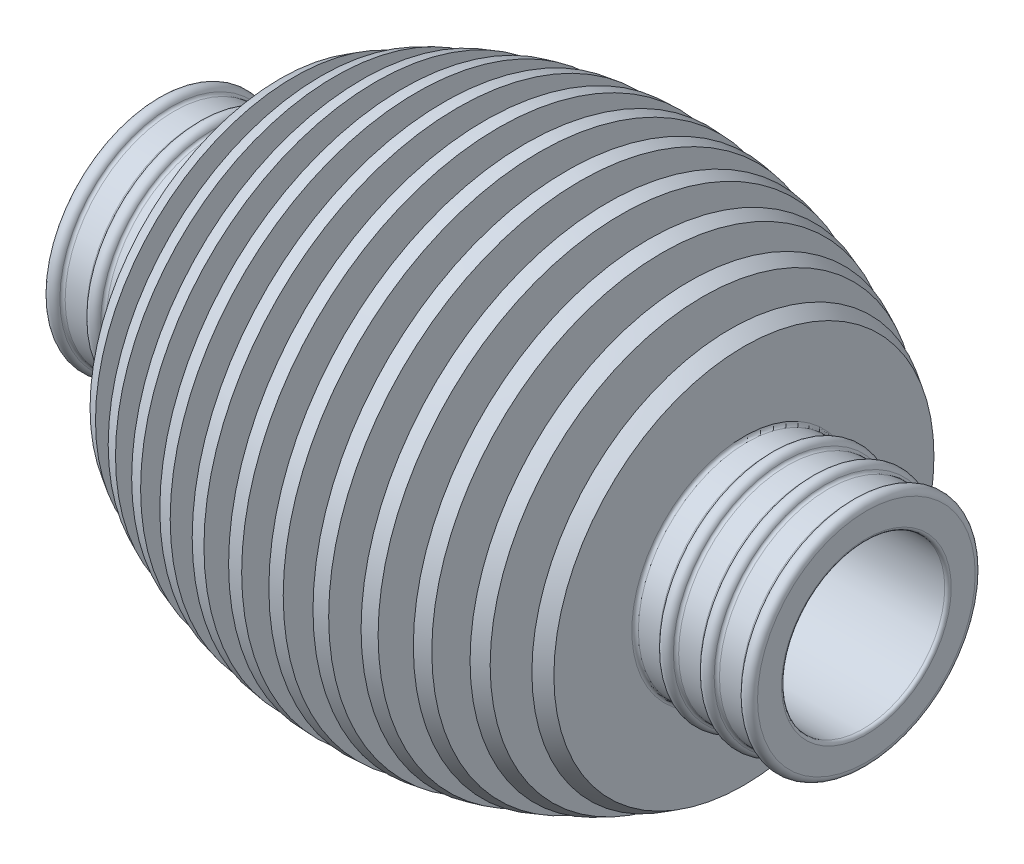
SolidWorks part; units mm, degrees
ref_plane "Front Plane" through (0, 0, 0) normal (0, 0, 1) x (1, 0, 0)
ref_plane "Top Plane" through (0, 0, 0) normal (0, 1, 0) x (1, 0, 0)
ref_plane "Right Plane" through (0, 0, 0) normal (1, 0, 0) x (0, 0, -1)
sketch "Sketch1" plane through (0, 0, 0) normal (0, 0, 1) x (1, 0, 0)
  line L0 (0, 0) -> (-38.2692, 0) construction
  line L1 (0, 9.525) -> (0, 12.7)
  line L2 (1.59, 12.7) -> (4.7625, 12.7)
  line L3 (0, 9.525) -> (82.7075, 9.525)
  line L4 (14.29, 31.75) -> (15.8902, 31.75)
  line L5 (15.8902, 31.75) -> (15.8902, 12.7)
  line L6 (14.29, 12.7) -> (14.29, 31.75)
  line L7 (15.8902, 12.7) -> (19.0652, 12.7)
  line L8 (19.0652, 12.7) -> (19.0652, 31.75)
  line L9 (19.0652, 31.75) -> (20.6654, 31.75)
  line L10 (6.3525, 12.7) -> (9.525, 12.7)
  line L11 (11.115, 12.7) -> (14.29, 12.7)
  line L12 (20.6654, 31.75) -> (20.6654, 12.7)
  line L13 (20.6654, 12.7) -> (23.8404, 12.7)
  line L14 (23.8404, 12.7) -> (23.8404, 31.75)
  line L15 (23.8404, 31.75) -> (25.4406, 31.75)
  line L16 (25.4406, 31.75) -> (25.4406, 12.7)
  line L17 (25.4406, 12.7) -> (28.6156, 12.7)
  line L18 (28.6156, 12.7) -> (28.6156, 31.75)
  line L19 (28.6156, 31.75) -> (30.2158, 31.75)
  line L20 (30.2158, 31.75) -> (30.2158, 12.7)
  line L21 (30.2158, 12.7) -> (33.3908, 12.7)
  line L22 (33.3908, 12.7) -> (33.3908, 31.75)
  line L23 (33.3908, 31.75) -> (34.991, 31.75)
  line L24 (34.991, 31.75) -> (34.991, 12.7)
  line L25 (34.991, 12.7) -> (38.166, 12.7)
  line L26 (38.166, 12.7) -> (38.166, 31.75)
  line L27 (38.166, 31.75) -> (39.7662, 31.75)
  line L28 (39.7662, 31.75) -> (39.7662, 12.7)
  line L29 (39.7662, 12.7) -> (42.9412, 12.7)
  line L30 (42.9412, 12.7) -> (42.9412, 31.75)
  line L31 (42.9412, 31.75) -> (44.5414, 31.75)
  line L32 (44.5414, 31.75) -> (44.5414, 12.7)
  line L33 (44.5414, 12.7) -> (47.7164, 12.7)
  line L34 (47.7164, 12.7) -> (47.7164, 31.75)
  line L35 (47.7164, 31.75) -> (49.3166, 31.75)
  line L36 (49.3166, 31.75) -> (49.3166, 12.7)
  line L37 (49.3166, 12.7) -> (52.4916, 12.7)
  line L38 (52.4916, 12.7) -> (52.4916, 31.75)
  line L39 (52.4916, 31.75) -> (54.0918, 31.75)
  line L40 (54.0918, 31.75) -> (54.0918, 12.7)
  line L41 (54.0918, 12.7) -> (57.2668, 12.7)
  line L42 (57.2668, 12.7) -> (57.2668, 31.75)
  line L43 (57.2668, 31.75) -> (58.867, 31.75)
  line L44 (58.867, 31.75) -> (58.867, 12.7)
  line L45 (58.867, 12.7) -> (62.042, 12.7)
  line L46 (62.042, 12.7) -> (62.042, 31.75)
  line L47 (62.042, 31.75) -> (63.6422, 31.75)
  line L48 (63.6422, 31.75) -> (63.6422, 12.7)
  line L49 (63.6422, 12.7) -> (66.8172, 12.7)
  line L50 (66.8172, 12.7) -> (66.8172, 31.75)
  line L51 (66.8172, 31.75) -> (68.4174, 31.75)
  line L52 (68.4174, 31.75) -> (68.4174, 12.7)
  line L53 (68.4174, 12.7) -> (71.5924, 12.7)
  line L54 (11.115, 12.7) -> (71.5924, 12.7) construction
  line L55 (41.3537, 12.7) -> (41.3537, 39.1478) construction
  line L56 (76.3549, 12.7) -> (73.1825, 12.7)
  line L57 (81.1174, 12.7) -> (77.945, 12.7)
  line L58 (82.7075, 9.525) -> (82.7075, 12.7)
  arc A0 (73.1825, 12.7) -> (71.5924, 12.7) centre (72.3875, 12.7) ccw
  arc A1 (77.945, 12.7) -> (76.3549, 12.7) centre (77.15, 12.7) ccw
  arc A2 (82.7075, 12.7) -> (81.1174, 12.7) centre (81.9125, 12.7) ccw
  arc A4 (0, 12.7) -> (1.59, 12.7) centre (0.795, 12.7) cw
  arc A5 (4.7625, 12.7) -> (6.3525, 12.7) centre (5.5575, 12.7) cw
  arc A6 (9.525, 12.7) -> (11.115, 12.7) centre (10.32, 12.7) cw
  point P66 (81.9125, 9.525)
  dimension "D2" = 0.795
  dimension "D8" = 1.6002
  dimension "D1" = 3.175
  dimension "D3" = 4.7625
  dimension "D4" = 4.7625
  dimension "D5" = 19.05
  dimension "D7" = 19.05
  dimension "D9" = 3.175
  dimension "D10" = 12
revolve "Revolve1" add sketch "Sketch1" angle 360 about L0
sketch "Sketch2" plane through (0, 0, 0) normal (0, 0, 1) x (1, 0, 0)
  line L0 (4.7625, 12.7) -> (1.59, 12.7) construction
  line L1 (81.1174, 12.7) -> (77.945, 12.7) construction
  line L2 (3.1763, 12.7) -> (3.1763, 38.1)
  line L3 (3.1763, 38.1) -> (79.5312, 38.1)
  line L4 (79.5312, 38.1) -> (79.5312, 12.7)
  line L5 (0, 0) -> (-35.6344, 0) construction
  arc A0 (3.1763, 12.7) -> (79.5312, 12.7) centre (41.3537, -20.813) cw
  dimension "D1" = 50.8
  dimension "D2" = 25.4
revolve "Cut-Revolve1" cut sketch "Sketch2" angle 360 about L5
fillet "Fillet1" radius 0.381 36 edges at (77.945, 0, -12.7) (81.1174, 0, -12.7) (76.3549, 0, -12.7) (73.1825, 0, -12.7) (71.5924, 0, -12.7) (68.4174, 0, -12.7) (66.8172, 0, -12.7) (63.6422, 0, -12.7) (62.042, 0, -12.7) (58.867, 0, -12.7) (57.2668, 0, -12.7) (54.0918, 0, -12.7) (52.4916, 0, -12.7) (49.3166, 0, -12.7) (47.7164, 0, -12.7) (44.5414, 0, -12.7) (42.9412, 0, -12.7) (39.7662, 0, -12.7) (38.166, 0, -12.7) (34.991, 0, -12.7) (33.3908, 0, -12.7) (30.2158, 0, -12.7) (28.6156, 0, -12.7) (25.4406, 0, -12.7) (23.8404, 0, -12.7) (20.6654, 0, -12.7) (19.0652, 0, -12.7) (15.8902, 0, -12.7) (14.29, 0, -12.7) (11.115, 0, -12.7) (9.525, 0, -12.7) (6.3525, 0, -12.7) (4.7625, 0, -12.7) (1.59, 0, -12.7) (0, 0, -9.525) (82.7075, 0, -9.525)
